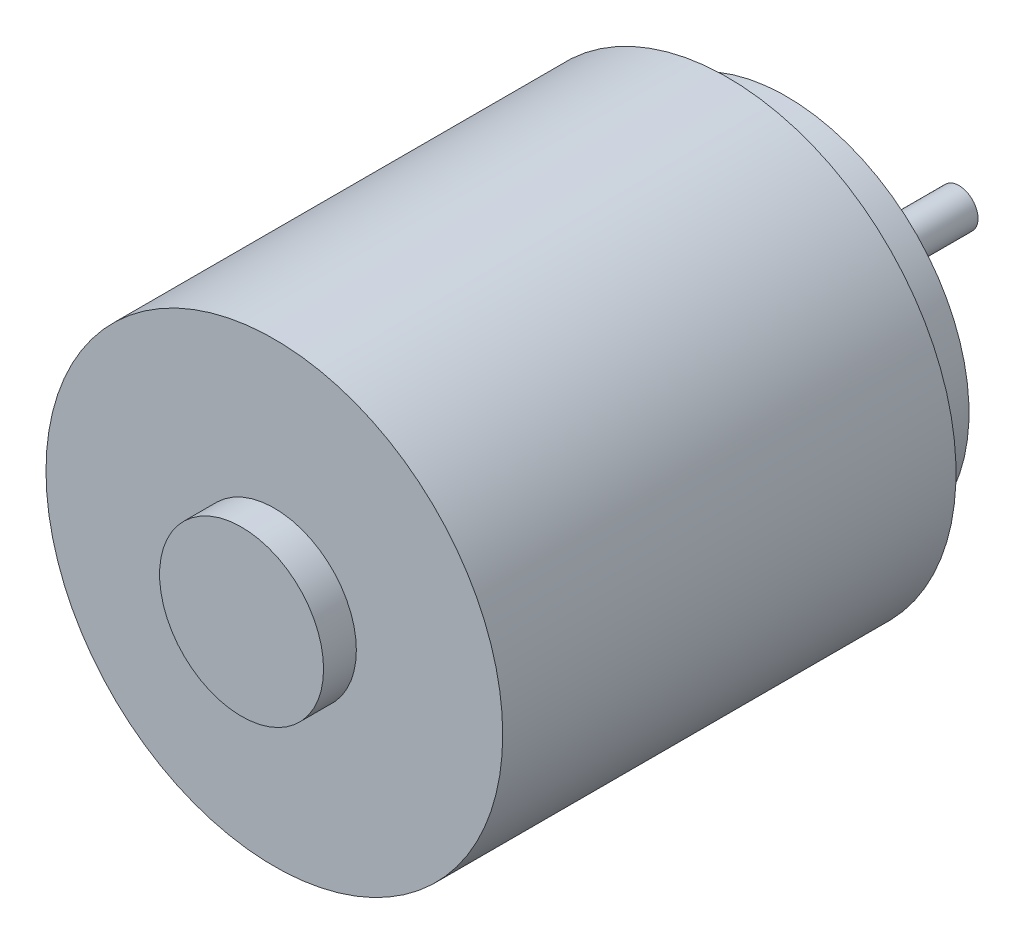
SolidWorks part; units mm, degrees
ref_plane "Front" through (0, 0, 0) normal (0, 0, 1) x (1, 0, 0)
ref_plane "Top" through (0, 0, 0) normal (0, 1, 0) x (1, 0, 0)
ref_plane "Right" through (0, 0, 0) normal (1, 0, 0) x (0, 0, -1)
sketch "Sketch2" plane through (0, 0, 0) normal (0, 0, 1) x (1, 0, 0)
  circle A0 centre (0, 0) radius 11.8364
  dimension "D1" = 23.6728
extrude "Main Body" add sketch "Sketch2" along normal blind 26.543
sketch "Sketch3" plane through (0, 0, 26.543) normal (0, 0, 1) x (1, 0, 0)
  circle A0 centre (0, 0) radius 4.25
extrude "Back Nub" add sketch "Sketch3" along normal blind 1.7
sketch "Sketch4" plane through (0, 0, 0) normal (0, 0, -1) x (-1, 0, 0)
  circle A0 centre (0, 0) radius 9.4615
extrude "Front Nub" cut sketch "Sketch4" against normal blind 3.048 flip side to cut
sketch "Sketch5" plane through (0, 0, 0) normal (0, 0, -1) x (-1, 0, 0)
  circle A0 centre (0, 0) radius 3.0099
extrude "Shaft Nub" add sketch "Sketch5" along normal blind 1.7
sketch "Sketch6" plane through (0, 0, -1.7) normal (0, 0, -1) x (-1, 0, 0)
  circle A0 centre (0, 0) radius 0.9906
extrude "Shaft" add sketch "Sketch6" along normal blind 7.239
